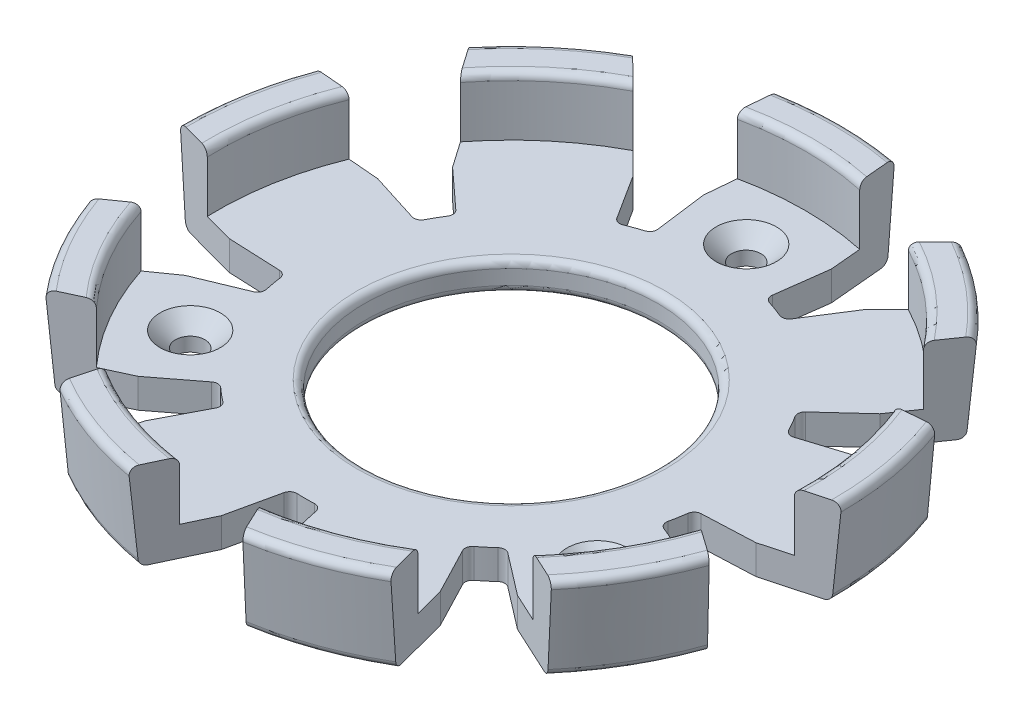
SolidWorks part; units mm, degrees
ref_plane "Plan de face" through (0, 0, 0) normal (0, 0, 1) x (1, 0, 0)
ref_plane "Plan de dessus" through (0, 0, 0) normal (0, 1, 0) x (1, 0, 0)
ref_plane "Plan de droite" through (0, 0, 0) normal (1, 0, 0) x (0, 0, -1)
ref_plane "Plan4" through (0, 2, 0) normal (0, 1, 0) x (-1, 0, 0)
sketch "Esquisse1" plane through (0, 2, 0) normal (0, 1, 0) x (-1, 0, 0)
  line L20 (-3.8364, -13.4641) -> (-4.3585, -17.4299)
  line L21 (-4.3585, -17.4299) -> (-3.9785, -21.6373)
  line L22 (3.9785, -21.6373) -> (4.3585, -17.4299)
  line L23 (4.3585, -17.4299) -> (3.8364, -13.4641)
  line L44 (0, 0) -> (-4.7883, -13.1557)
  line L45 (0, 0) -> (4.7883, -13.1557)
  arc A7 (-4.7883, -13.1557) -> (-3.8364, -13.4641) centre (0, 0) ccw
  arc A8 (-3.9785, -21.6373) -> (3.9785, -21.6373) centre (0, 0) ccw
  arc A9 (3.8364, -13.4641) -> (4.7883, -13.1557) centre (0, 0) ccw
  dimension "D1" = 22
extrude "Extrusion1" add sketch "Esquisse1" against normal blind 2
sketch "Esquisse18" plane through (0, 2, 0) normal (0, 1, 0) x (1, 0, 0)
  line L0 (3.9785, 21.6373) -> (4.166, 19.5613)
  line L1 (4.3585, 17.4299) -> (3.9785, 21.6373) construction
  line L2 (-3.9785, 21.6373) -> (-4.166, 19.5613)
  line L3 (-3.9785, 21.6373) -> (-4.3585, 17.4299) construction
  arc A0 (3.9785, 21.6373) -> (-3.9785, 21.6373) centre (0, 0) ccw
  arc A1 (4.166, 19.5613) -> (-4.166, 19.5613) centre (0, 0) ccw
  dimension "D1" = 2
extrude "Extrusion13" add sketch "Esquisse18" along normal blind 4
draft "Dépouille1" type of draft neutral plane draft angle 5 faces to draft 1 parameters "D1"=5
fillet "Congé75" radius 0.5 5 edges at (3.8364, 1, -13.4641) (0, 0, -22) (-3.8364, 1, -13.4641) (0, 6, -20) (0, 6, -22.5249)
pattern_circular "Répétition circulaire1" count 9 over 360 about axis through (0, 0, 0) along (0, 1, 0) of "Extrusion1", "Extrusion13", "Dépouille1", "Congé75"
sketch "Esquisse11" plane through (0, 0, 0) normal (0, -1, 0) x (1, 0, 0)
  circle A0 centre (0, 0) radius 10
extrude "Extrusion11" cut sketch "Esquisse11" against normal up to next
hole_wizard "Perçage1" positions "Esquisse13" profile "Esquisse12" legacy
sketch "Esquisse13" plane through (0, 2, 0) normal (0, 1, 0) x (-1, 0, 0)
  point P0 (-13.8564, 8)
sketch "Esquisse12" plane through (13.8564, 2, 8) normal (1, 0, 0) x (0, 0, 1)
  line L0 (0, 0) -> (0, 2.001)
  line L1 (0, 2.001) -> (1, 2.001)
  line L2 (1, 2.001) -> (1, 1.054)
  line L3 (1, 1.054) -> (2.054, 0)
  line L4 (2.054, 0) -> (0, 0)
  line L5 (0, -6.4453) -> (0, 115.525) construction
  line L6 (-1, 1.054) -> (-2.054, 0) construction
  dimension "Diamètre" = 2
  dimension "Profondeur" = 2.001
  dimension "Angle fraisé" = 90
  dimension "Diamètre fraisé" = 4.108
fillet "Congé76" radius 0.5 2 edges at (0, 2, 10) (0, 0, 10)
pattern_circular "Répétition circulaire2" count 3 every 120 about axis through (0, 0, 0) along (0, 1, 0) of "Perçage1"
hole_wizard "Perçage2" positions "Esquisse15" profile "Esquisse14" legacy
sketch "Esquisse15" plane through (0, 2, 0) normal (0, 1, 0) x (-1, 0, 0)
  point P0 (13.8564, 8)
sketch "Esquisse14" plane through (-13.8564, 2, 8) normal (1, 0, 0) x (0, 0, 1)
  line L0 (0, 0) -> (0, 2.031)
  line L1 (0, 2.031) -> (1, 2.031)
  line L2 (1, 2.031) -> (1, 1.054)
  line L3 (1, 1.054) -> (2.054, 0)
  line L4 (2.054, 0) -> (0, 0)
  line L5 (0, -6.4453) -> (0, 115.525) construction
  line L6 (-1, 1.054) -> (-2.054, 0) construction
  dimension "Diamètre" = 2
  dimension "Profondeur" = 2.031
  dimension "Angle fraisé" = 90
  dimension "Diamètre fraisé" = 4.108
hole_wizard "Perçage3" positions "Esquisse17" profile "Esquisse16" legacy
sketch "Esquisse17" plane through (0, 2, 0) normal (0, 1, 0) x (-1, 0, 0)
  point P0 (0, -16)
sketch "Esquisse16" plane through (0, 2, -16) normal (1, 0, 0) x (0, 0, 1)
  line L0 (0, 0) -> (0, 2.031)
  line L1 (0, 2.031) -> (1, 2.031)
  line L2 (1, 2.031) -> (1, 1.054)
  line L3 (1, 1.054) -> (2.054, 0)
  line L4 (2.054, 0) -> (0, 0)
  line L5 (0, -6.4453) -> (0, 115.525) construction
  line L6 (-1, 1.054) -> (-2.054, 0) construction
  dimension "Diamètre" = 2
  dimension "Profondeur" = 2.031
  dimension "Angle fraisé" = 90
  dimension "Diamètre fraisé" = 4.108
